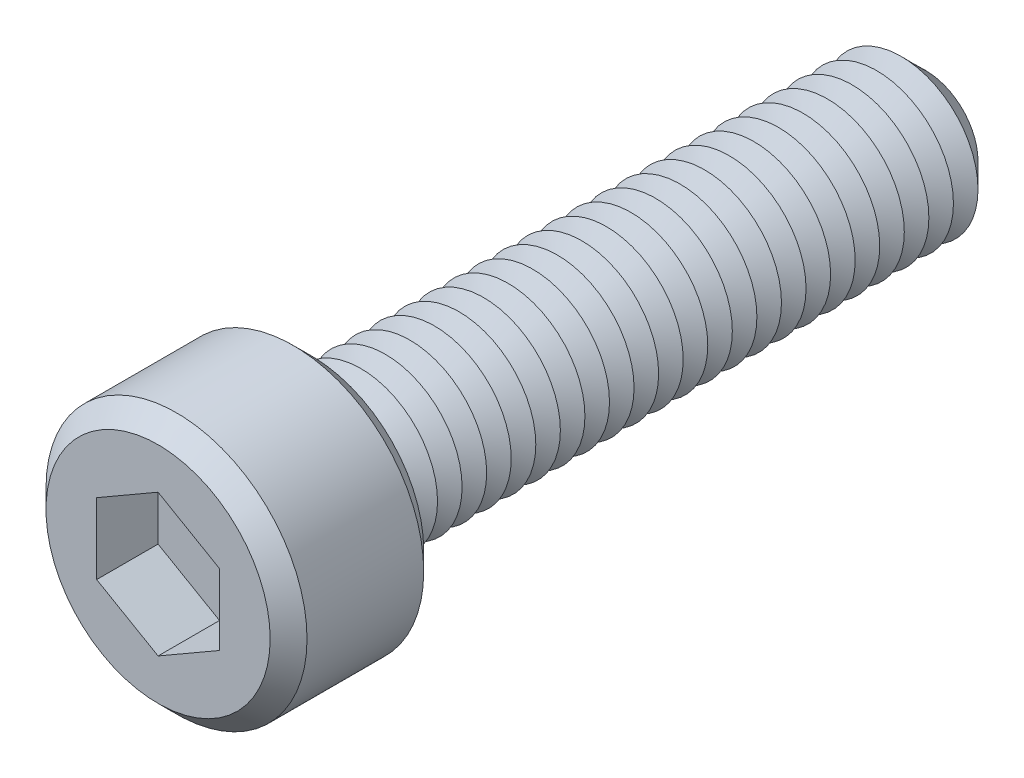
SolidWorks part; units mm, degrees
ref_plane "Front Plane" through (0, 0, 0) normal (0, 0, 1) x (1, 0, 0)
ref_plane "Top Plane" through (0, 0, 0) normal (0, 1, 0) x (1, 0, 0)
ref_plane "Right Plane" through (0, 0, 0) normal (1, 0, 0) x (0, 0, -1)
sketch "Sketch1" plane through (0, 0, 0) normal (0, 0, 1) x (1, 0, 0)
  circle A0 centre (0, 0) radius 4.25
  dimension "D1" = 8.5
extrude "Boss-Extrude1" add sketch "Sketch1" along normal blind 5
sketch "Sketch2" plane through (0, 0, 0) normal (0, 0, -1) x (-1, 0, 0)
  circle A0 centre (0, 0) radius 2.5
  dimension "D1" = 5
extrude "Boss-Extrude2" add sketch "Sketch2" along normal blind 20
chamfer "Chamfer1" distance 0.8 angle 45 1 edges at (-2.5, 0, -20)
sketch "Sketch3" plane through (0, 0, 0) normal (1, 0, 0) x (0, 0, -1)
  line L0 (-2.5121, 0) -> (4.5776, 0) construction
sketch "Sketch4" plane through (0, 0, 0) normal (1, 0, 0) x (0, 0, -1)
  line L0 (0, 2.5) -> (0.4, 1.8072)
  line L1 (0.4, 1.8072) -> (0.8, 2.5)
  line L2 (19.2, 2.5) -> (0, 2.5) construction
  line L3 (0.8, 2.5) -> (0, 2.5)
  dimension "D1" = 0.8
revolve "Cut-Revolve1" cut sketch "Sketch4" angle 360 about L0
pattern_linear "LPattern1" count 24 spacing 0.8 along (0, 0, -1) of "Cut-Revolve1"
sketch "Sketch5" plane through (0, 0, 5) normal (0, 0, 1) x (1, 0, 0)
  line L1 (0, 2.3094) -> (-2, 1.1547)
  line L2 (-2, 1.1547) -> (-2, -1.1547)
  line L3 (-2, -1.1547) -> (0, -2.3094)
  line L4 (0, -2.3094) -> (2, -1.1547)
  line L5 (2, -1.1547) -> (2, 1.1547)
  line L6 (2, 1.1547) -> (0, 2.3094)
  circle A0 centre (0, 0) radius 2 construction
  dimension "D1" = 4
extrude "Cut-Extrude1" cut sketch "Sketch5" against normal blind 2
sketch "Sketch6" plane through (0, 0, 3) normal (0, 0, 1) x (1, 0, 0)
  circle A0 centre (0, 0) radius 0.65
  dimension "D1" = 1.3
extrude "Cut-Extrude2" cut sketch "Sketch6" against normal up to surface (23 mm away)
chamfer "Chamfer2" distance 0.6 angle 45 2 edges at (4.25, 0, 0) (4.25, 0, 5)
